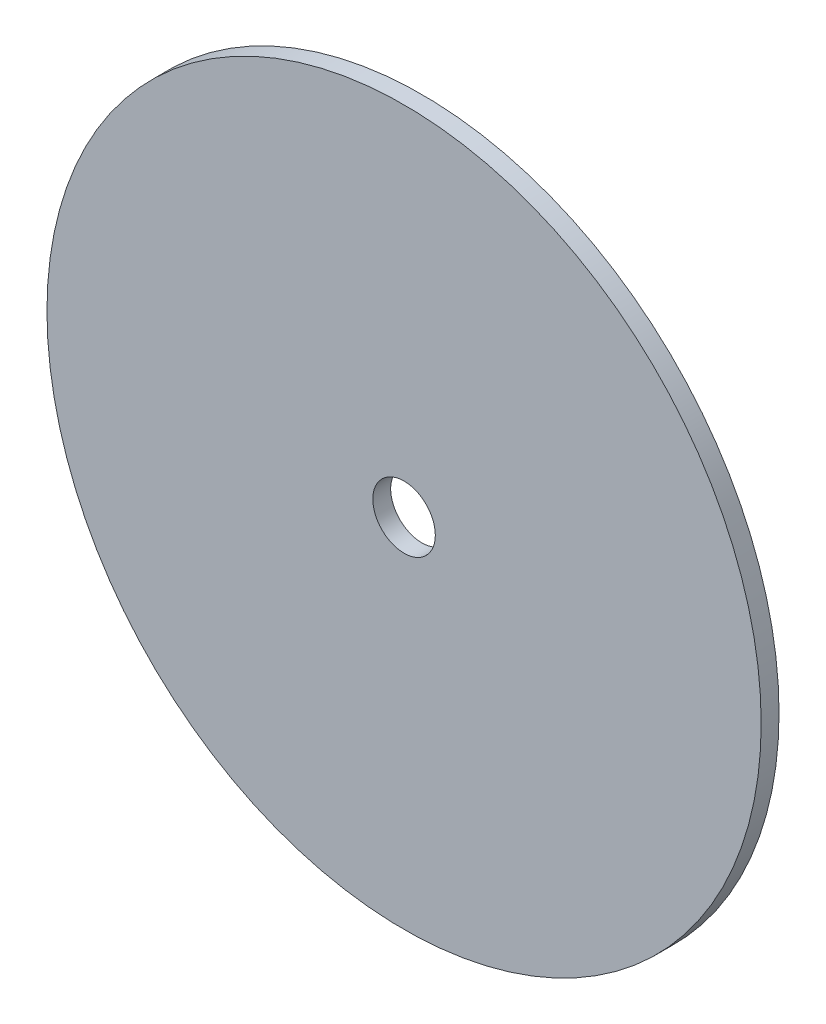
SolidWorks part; units mm, degrees
ref_plane "Alzado" through (0, 0, 0) normal (0, 0, 1) x (1, 0, 0)
ref_plane "Planta" through (0, 0, 0) normal (0, 1, 0) x (1, 0, 0)
ref_plane "Vista lateral" through (0, 0, 0) normal (1, 0, 0) x (0, 0, -1)
sketch "Croquis1" plane through (0, 0, 0) normal (0, 0, 1) x (1, 0, 0)
  circle A0 centre (0, 0) radius 20
  circle A1 centre (0, 0) radius 1.75
  dimension "D1" = 40
  dimension "D2" = 3.5
extrude "Saliente-Extruir1" add sketch "Croquis1" along normal blind 1
